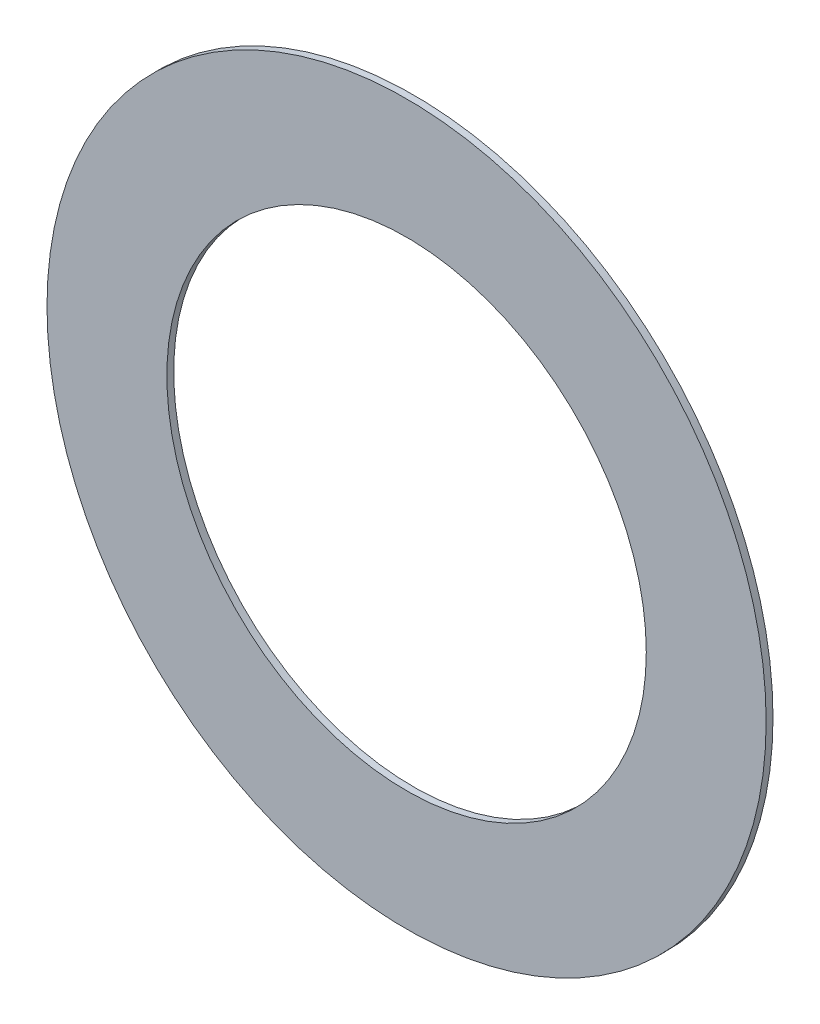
SolidWorks part; units mm, degrees
ref_plane "Face" through (0, 0, 0) normal (0, 0, 1) x (1, 0, 0)
ref_plane "Dessus" through (0, 0, 0) normal (0, 1, 0) x (1, 0, 0)
ref_plane "Droite" through (0, 0, 0) normal (1, 0, 0) x (0, 0, -1)
ref_plane "Plan4" through (0, 0, -0.2) normal (0, 0, -1) x (-1, 0, 0)
sketch "Esquisse1" plane through (0, 0, -0.2) normal (0, 0, -1) x (-1, 0, 0)
  circle A0 centre (0, 0) radius 7
  circle A1 centre (0, 0) radius 10.5
extrude "Base-Extrusion" add sketch "Esquisse1" against normal blind 0.2
